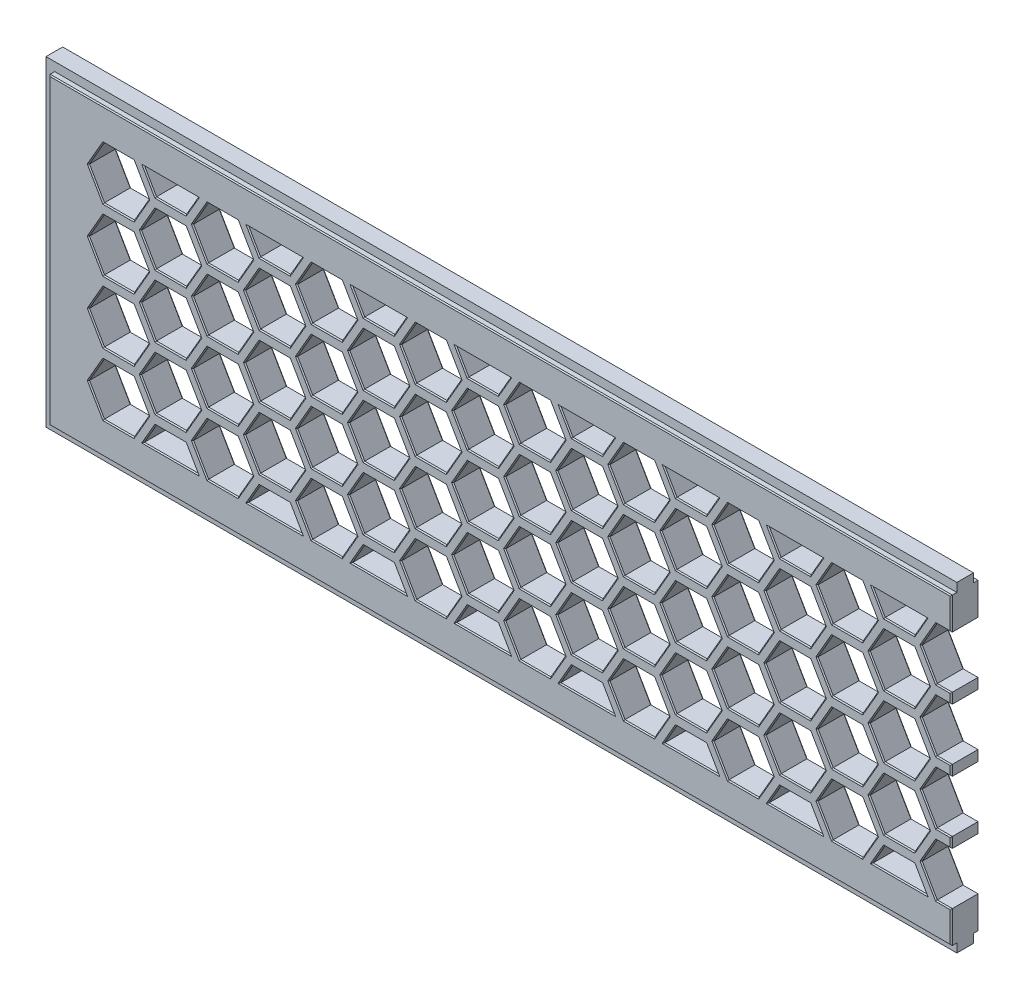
SolidWorks part; units mm, degrees
ref_plane "Aufriss" through (0, 0, 0) normal (0, 0, 1) x (1, 0, 0)
ref_plane "Grundriss" through (0, 0, 0) normal (0, 1, 0) x (1, 0, 0)
ref_plane "Seitenriss" through (0, 0, 0) normal (1, 0, 0) x (0, 0, -1)
sketch "Skizze1" plane through (0, 0, 0) normal (0, 0, 1) x (1, 0, 0)
  line L1 (-395, -43.75) -> (395, -43.75)
  line L2 (-395, -43.75) -> (-395, 43.75)
  line L3 (-395, 43.75) -> (395, 43.75)
  line L4 (395, -43.75) -> (395, 43.75)
  line L5 (-395, -43.75) -> (395, 43.75) construction
  line L6 (-395, 43.75) -> (395, -43.75) construction
  point P0 (0, 0)
  dimension "D1" = 790
  dimension "D2" = 87.5
extrude "Aufsatz-Linear austragen1" add sketch "Skizze1" along normal mid plane 8
sketch "Skizze2" plane through (0, 0, 4) normal (0, 0, 1) x (1, 0, 0)
  line L0 (-395, 43.75) -> (-395, -43.75) construction
  line L1 (-370.6699, 34.5) -> (-379.3301, 34.5)
  line L2 (-379.3301, 34.5) -> (-383.6603, 27)
  line L3 (-383.6603, 27) -> (-379.3301, 19.5)
  line L4 (-379.3301, 19.5) -> (-370.6699, 19.5)
  line L5 (-370.6699, 19.5) -> (-366.3397, 27)
  line L6 (-366.3397, 27) -> (-370.6699, 34.5)
  line L7 (395, 43.75) -> (-395, 43.75) construction
  circle A0 centre (-375, 27) radius 7.5 construction
  dimension "D1" = 20
  dimension "D2" = 16.75
  dimension "D3" = 15
extrude "Schnitt-Linear austragen1" cut sketch "Skizze2" against normal through all
pattern_linear "Lineares Muster1" count 26 spacing 30 along (1, 0, 0) count 4 spacing 18 along (0, -1, 0) of "Schnitt-Linear austragen1"
sketch "Skizze3" plane through (0, 0, 4) normal (0, 0, 1) x (1, 0, 0)
  line L0 (-370.6699, 34.5) -> (-379.3301, 34.5) construction
  line L1 (-364.3301, 25.5) -> (-368.6603, 18)
  line L2 (-368.6603, 18) -> (-364.3301, 10.5)
  line L3 (-364.3301, 10.5) -> (-355.6699, 10.5)
  line L4 (-355.6699, 10.5) -> (-351.3397, 18)
  line L5 (-351.3397, 18) -> (-355.6699, 25.5)
  line L6 (-355.6699, 25.5) -> (-364.3301, 25.5)
  line L7 (-395, 43.75) -> (-395, -43.75) construction
  line L8 (395, 43.75) -> (-395, 43.75) construction
  circle A0 centre (-360, 18) radius 7.5 construction
  dimension "D1" = 35
  dimension "D2" = 25.75
extrude "Schnitt-Linear austragen2" cut sketch "Skizze3" against normal through all
pattern_linear "Lineares Muster2" count 25 spacing 30 along (1, 0, 0) count 4 spacing 18 along (0, -1, 0) of "Schnitt-Linear austragen2"
pattern_linear "Lineares Muster3" count 2 spacing 18 along (0, 1, 0) count 25 spacing 30 along (1, 0, 0) of "Schnitt-Linear austragen2"
sketch "Skizze4" plane through (0, 0, 4) normal (0, 0, 1) x (1, 0, 0)
  line L0 (395, -43.75) -> (395, 43.75) construction
  line L1 (-395, 43.75) -> (395, 43.75)
  line L3 (-395, 34.5) -> (395, 34.5)
  line L4 (395, 43.75) -> (395, 34.5)
  line L5 (-395, 43.75) -> (-395, -43.75) construction
  line L6 (395, -43.75) -> (-395, -43.75)
  line L7 (395, -43.75) -> (395, -34.5)
  line L8 (395, -34.5) -> (-395, -34.5)
  line L9 (-395, -43.75) -> (-395, -34.5)
  line L11 (-379.3301, -34.5) -> (-370.6699, -34.5) construction
  line L12 (-370.6699, 34.5) -> (-379.3301, 34.5) construction
  line L14 (-395, 34.5) -> (-395, 43.75)
extrude "Aufsatz-Linear austragen2" add sketch "Skizze4" against normal up to surface (8 mm away)
sketch "Skizze5" plane through (0, 0, 0) normal (0, 0, 1) x (1, 0, 0)
  line L1 (-395, 43.75) -> (395, 43.75)
  line L2 (-395, 43.75) -> (-395, -43.75)
  line L3 (-395, -43.75) -> (395, -43.75)
  line L4 (395, 43.75) -> (395, -43.75)
  line L5 (-397.5, 46.25) -> (397.5, 46.25)
  line L6 (-397.5, 46.25) -> (-397.5, -46.25)
  line L7 (-397.5, -46.25) -> (397.5, -46.25)
  line L8 (397.5, 46.25) -> (397.5, -46.25)
  dimension "D1" = 2.5
  dimension "D2" = 2.5
  dimension "D3" = 2.5
  dimension "D4" = 2.5
extrude "Aufsatz-Linear austragen3" add sketch "Skizze5" along normal mid plane 4.8
sketch "Skizze6" plane through (0, 0, 4) normal (0, 0, 1) x (1, 0, 0)
  line L0 (397.5, 46.25) -> (-397.5, 46.25) construction
  line L1 (-135, -46.25) -> (397.5, -46.25)
  line L2 (-135, -46.25) -> (-135, 46.25)
  line L3 (-135, 46.25) -> (397.5, 46.25)
  line L4 (397.5, -46.25) -> (397.5, 46.25)
  line L8 (-130.6699, 34.5) -> (-139.3301, 34.5) construction
  point P0 (0, 0)
  point P10 (-135, 34.5)
extrude "Schnitt-Linear austragen3" cut sketch "Skizze6" against normal through all both and the other way through all
chamfer "Fase1" distance 0.3 angle 45
